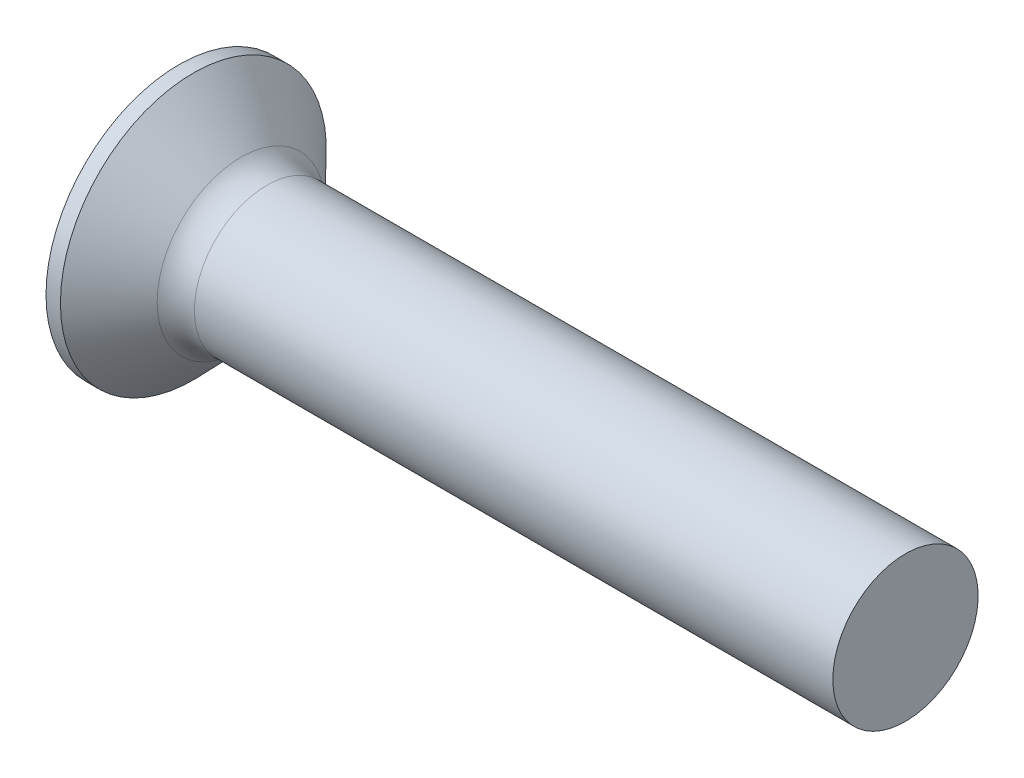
SolidWorks part; units mm, degrees
ref_plane "Plane1" through (0, 0, 0) normal (0, 0, 1) x (1, 0, 0)
ref_plane "Plane2" through (0, 0, 0) normal (0, 1, 0) x (1, 0, 0)
ref_plane "Plane3" through (0, 0, 0) normal (1, 0, 0) x (0, 0, -1)
sketch "BodySke" plane through (0, 0, 0) normal (0, 0, 1) x (1, 0, 0)
  line L0 (0, 0) -> (0, 9.15)
  line L1 (0, 9.15) -> (0.9924, 9.15)
  line L2 (5, 5) -> (50, 5)
  line L3 (50, 5) -> (50, 0)
  line L4 (50, 0) -> (0, 0)
  line L5 (-6.35, 0) -> (82.55, 0) construction
  line L6 (5, -5) -> (50, -5) construction
  line L7 (0.9924, -9.15) -> (5, -5) construction
  line L8 (0.9924, 9.15) -> (5, 5)
  line L9 (0, -9.15) -> (0.9924, -9.15) construction
  line L10 (6.5, 6.5875) -> (6.5, -2.9375) construction
  line L11 (0, 6.35) -> (0, -3.175) construction
  dimension "Diameter" = 10
  dimension "Length" = 50
  dimension "Head_ht" = 5
  dimension "Head_dia" = 18.3
  dimension "Head_ang" = 92
  dimension "D6" = 0.9924
  dimension "Advance" = 1.5
  dimension "Thread_nom" = 50
revolve "Base-Revolve" add sketch "BodySke" angle 360 about L5
fillet "Fillet1" radius 2.5 1 edges at (5, 0, 5)
sketch "Sketch3" plane through (0, 0, 0) normal (-1, 0, 0) x (0, 0, 1)
  line L0 (-1.08, 4.9) -> (1.08, 4.9)
  line L1 (1.08, 4.9) -> (1.08, -4.9)
  line L2 (1.08, -4.9) -> (-1.08, -4.9)
  line L3 (-1.08, -4.9) -> (-1.08, 4.9)
  dimension "D1" = 4.9
  dimension "Cross_dia" = 9.8
  dimension "D2" = 1.08
  dimension "Cross_width" = 2.16
ref_plane "Plane4" through (5.64, 0, 0) normal (-1, 0, 0) x (0, 0, 1)
sketch "Sketch4" plane through (5.64, 0, 0) normal (-1, 0, 0) x (0, 0, 1)
  line L0 (-1.08, 2.088) -> (1.08, 2.088)
  line L3 (1.08, 2.088) -> (1.08, -2.088)
  line L4 (1.08, -2.088) -> (-1.08, -2.088)
  line L5 (-1.08, -2.088) -> (-1.08, 2.088)
  dimension "D1" = 2.16
  dimension "D2" = 4.176
  dimension "D3" = 1.08
  dimension "D4" = 2.088
loft "Recess" cut profiles "Sketch3", "Sketch4"
pattern_circular "RecPat" count 2 every 90 about axis through (0, 0, 0) along (1, 0, 0) of "Recess"
sketch "RecCorSke" plane through (0, 0, 0) normal (0, 0, 1) x (1, 0, 0)
  line L0 (-3.175, 0) -> (15.875, 0) construction
  line L2 (0, 0) -> (0, 2.3249)
  line L3 (0, 2.3249) -> (5.64, 1.9305)
  line L4 (5.64, 1.9305) -> (6.2673, 0)
  line L5 (6.2673, 0) -> (0, 0)
  dimension "Diameter" = 3.861
  dimension "Depth" = 5.64
  dimension "Draft_angle" = 4
  dimension "Bottom_angle" = 18
revolve "RecessCore" cut sketch "RecCorSke" angle 360 about L0
sketch "ThdSchSke" plane through (0, 0, 0) normal (0, 0, 1) x (1, 0, 0)
  line L0 (6.5, -3.9624) -> (5.7735, -5)
  line L1 (6.5, -3.9624) -> (7.2265, -5)
  line L2 (7.2265, -5) -> (7.2265, -6.25)
  line L3 (-3.175, 0) -> (5.1513, 0) construction
  line L5 (7.2265, -6.25) -> (5.7735, -6.25)
  line L6 (5.7735, -6.25) -> (5.7735, -5)
  line L7 (0, 9.15) -> (0, -9.15) construction
  dimension "Thread_minor" = 7.9248
  dimension "Diameter" = 10
  dimension "Start" = 6.5
  dimension "SideAngle" = 55
  dimension "VeeAngle" = 70
  dimension "Overcut" = 12.5
revolve "ThreadSchematic" [suppressed] cut sketch "ThdSchSke" angle 360 about L3
pattern_linear "ThdSchPat" [suppressed]
equation "\"D1@Sketch3\" = \"Cross_dia@Sketch3\" / 2"
equation "\"D2@Sketch3\" = \"Cross_width@Sketch3\" / 2"
equation "\"Depth@RecCorSke\" = \"Cross_depth@Plane4\""
equation "\"D1@Sketch4\" = \"Cross_width@Sketch3\""
equation "\"D2@Sketch4\" = \"Cross_dia@Sketch3\" - 2.0 * \"Cross_depth@Plane4\" * tan(26.5  * 0.017453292)"
equation "\"D3@Sketch4\" = \"D1@Sketch4\" / 2"
equation "\"D4@Sketch4\" = \"D2@Sketch4\" / 2"
equation "\"Thread_length@ThreadCosmetic\" = ((sgn( (\"Length@BodySke\" - \"Advance@BodySke\" * 1.0 - \"Head_ht@BodySke\" ) - \"Thread_nom@BodySke\" )-1)*( (\"Length@BodySke\" - \"Advance@BodySke\" * 1.0 - \"Head_ht@BodySke\" "
equation "\"Thread_minor@ThdSchSke\" = \"Thread_minor@ThreadCosmetic\""
equation "\"Diameter@ThdSchSke\" = \"Diameter@BodySke\""
equation "\"Overcut@ThdSchSke\" = \"Diameter@BodySke\" * 1.25"
equation "\"Start@ThdSchSke\" = 0.000001 + \"Length@BodySke\" - \"Thread_length@ThreadCosmetic\"  '---Countersunk---"
equation "\"Num_threads@ThdSchPat\" = int( \"Thread_length@ThreadCosmetic\" / \"Advance@BodySke\" + 0.999 )  + 1"
equation "\"Advance@ThdSchPat\" = \"Thread_length@ThreadCosmetic\" /  (\"Num_threads@ThdSchPat\" - 1) 'relax it"
